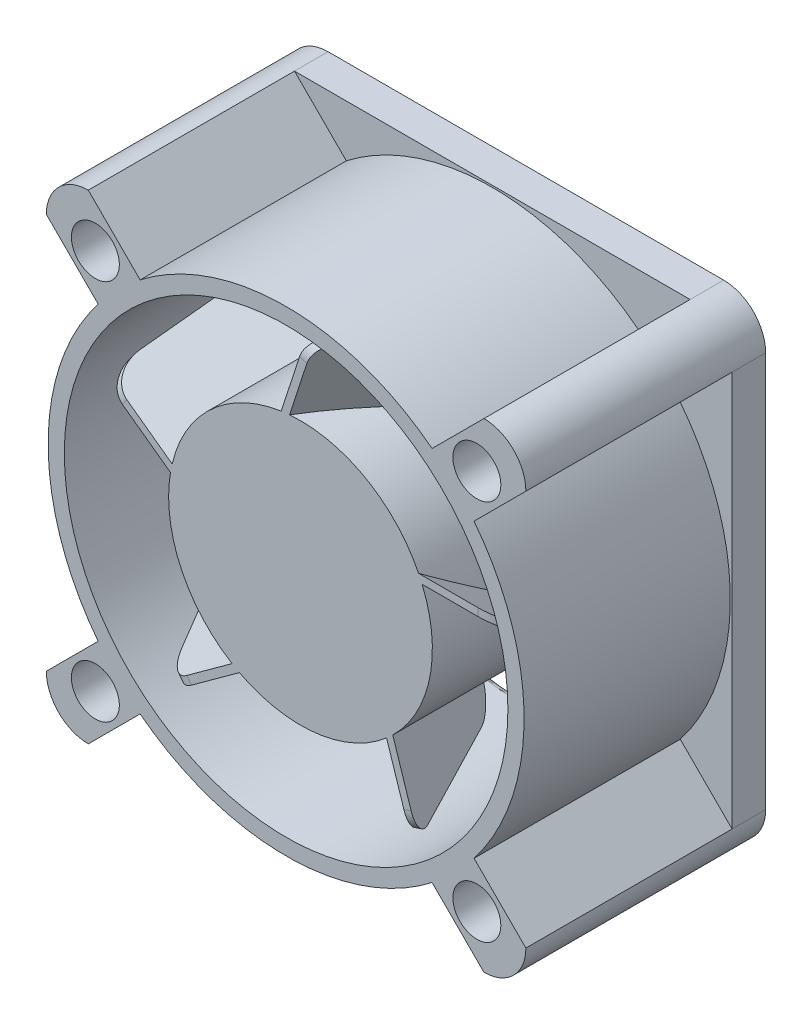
SolidWorks part; units mm, degrees
ref_plane "Face" through (0, 0, 0) normal (0, 0, 1) x (1, 0, 0)
ref_plane "Dessus" through (0, 0, 0) normal (0, 1, 0) x (1, 0, 0)
ref_plane "Droite" through (0, 0, 0) normal (1, 0, 0) x (0, 0, -1)
sketch "Esquisse1" plane through (0, 0, 0) normal (0, 0, 1) x (1, 0, 0)
  line L1 (-20.8134, 14.3716) -> (19.1866, 14.3716)
  line L2 (-20.8134, 14.3716) -> (-20.8134, -25.6284)
  line L3 (-20.8134, -25.6284) -> (19.1866, -25.6284)
  line L4 (19.1866, 14.3716) -> (19.1866, -25.6284)
  dimension "D1" = 40
  dimension "D2" = 40
extrude "Extrusion1" add sketch "Esquisse1" along normal blind 2.8
fillet "Congé1" radius 3.5 4 edges at (-20.8134, -25.6284, 1.4) (19.1866, -25.6284, 1.4) (19.1866, 14.3716, 1.4) (-20.8134, 14.3716, 1.4)
sketch "Esquisse2" plane through (0, 0, 2.8) normal (0, 0, 1) x (1, 0, 0)
  line L0 (-0.8134, 14.3716) -> (-0.8134, -24.6532) construction
  line L1 (15.6866, 14.3716) -> (-17.3134, 14.3716) construction
  line L2 (-20.8134, -5.6284) -> (15.6866, -5.6284) construction
  line L3 (-20.8134, 10.8716) -> (-20.8134, -22.1284) construction
  line L4 (-0.8134, -5.6284) -> (-21.1971, 14.7553) construction
  line L5 (-0.8134, -5.6284) -> (20.0819, 15.2669) construction
  line L6 (-0.8134, -5.6284) -> (20.0819, -26.5237) construction
  line L7 (-0.8134, -5.6284) -> (-20.8134, -25.6284) construction
  line L8 (-20.8134, 10.8716) -> (-16.4899, 6.5481)
  line L9 (-17.3134, 14.3716) -> (-12.9899, 10.0481)
  line L10 (15.6866, 14.3716) -> (11.3632, 10.0481)
  line L11 (19.1866, 10.8716) -> (14.8632, 6.5481)
  line L12 (19.1866, -22.1284) -> (14.8632, -17.805)
  line L13 (15.6866, -25.6284) -> (11.3632, -21.305)
  line L14 (-17.3134, -25.6284) -> (-12.9899, -21.305)
  line L15 (-20.8134, -22.1284) -> (-16.4899, -17.805)
  arc A0 (-17.3134, 14.3716) -> (-20.8134, 10.8716) centre (-17.3134, 10.8716) ccw construction
  arc A1 (-17.3134, 14.3716) -> (-20.8134, 10.8716) centre (-17.3134, 10.8716) ccw
  arc A2 (19.1866, 10.8716) -> (15.6866, 14.3716) centre (15.6866, 10.8716) ccw construction
  arc A3 (19.1866, 10.8716) -> (15.6866, 14.3716) centre (15.6866, 10.8716) ccw
  arc A4 (15.6866, -25.6284) -> (19.1866, -22.1284) centre (15.6866, -22.1284) ccw construction
  arc A5 (15.6866, -25.6284) -> (19.1866, -22.1284) centre (15.6866, -22.1284) ccw
  arc A6 (-20.8134, -22.1284) -> (-17.3134, -25.6284) centre (-17.3134, -22.1284) ccw construction
  arc A7 (-20.8134, -22.1284) -> (-17.3134, -25.6284) centre (-17.3134, -22.1284) ccw
  arc A8 (-16.4899, 6.5481) -> (-16.4899, -17.805) centre (-0.8134, -5.6284) ccw
  arc A9 (11.3632, 10.0481) -> (-12.9899, 10.0481) centre (-0.8134, -5.6284) ccw
  arc A10 (14.8632, -17.805) -> (14.8632, 6.5481) centre (-0.8134, -5.6284) ccw
  arc A11 (-12.9899, -21.305) -> (11.3632, -21.305) centre (-0.8134, -5.6284) ccw
extrude "Extrusion2" add sketch "Esquisse2" along normal blind 17.2
sketch "Esquisse3" plane through (0, 0, 20) normal (0, 0, 1) x (1, 0, 0)
  line L0 (-0.8134, 14.3716) -> (-0.8134, -27.2112) construction
  line L1 (15.6866, 14.3716) -> (-17.3134, 14.3716) construction
  line L2 (-20.8134, -5.6284) -> (22.4, -5.6284) construction
  line L3 (-20.8134, 10.8716) -> (-20.8134, -22.1284) construction
  line L4 (-0.8134, -5.6284) -> (19.6343, 14.8192) construction
  line L5 (-0.8134, -5.6284) -> (-21.6767, 15.2349) construction
  line L6 (-0.8134, -5.6284) -> (-22.9237, -27.7387) construction
  line L7 (-0.8134, -5.6284) -> (20.4336, -26.8754) construction
  circle A0 centre (-0.8134, -5.6284) radius 18.5
  circle A2 centre (-16.7233, 10.2815) radius 2
  circle A3 centre (15.0965, 10.2815) radius 2.001
  circle A4 centre (15.0965, -21.5383) radius 2
  circle A5 centre (-16.7233, -21.5383) radius 2
extrude "Enlèv. mat.-Extru.1" cut sketch "Esquisse3" against normal blind 22
sketch "Esquisse4" plane through (0, 0, 0) normal (0, 0, -1) x (-1, 0, 0)
  line L0 (0.8134, 14.3716) -> (0.8134, -27.339) construction
  line L1 (-15.6866, 14.3716) -> (17.3134, 14.3716) construction
  line L2 (-19.1866, -5.6284) -> (23.771, -5.6284) construction
  line L3 (-19.1866, -22.1284) -> (-19.1866, 10.8716) construction
  line L4 (7.9732, -13.9793) -> (12.0684, -20.9361)
  line L5 (6.1553, -15.2442) -> (10.0404, -22.2375)
  line L6 (-10.1851, -5.4468) -> (-18.184, -5.3147)
  line L7 (-9.9986, -7.6535) -> (-18.071, -7.7217)
  line L8 (6.4699, 3.8057) -> (10.5838, 10.667)
  line L9 (4.4656, 4.7476) -> (8.4427, 11.7725)
  arc A0 (4.4656, 4.7476) -> (-10.1851, -5.4468) centre (0.8134, -5.6284) ccw
  arc A2 (10.0404, -22.2375) -> (12.0684, -20.9361) centre (0.8134, -5.6284) ccw
  arc A4 (10.5838, 10.667) -> (8.4427, 11.7725) centre (0.8134, -5.6284) ccw
  arc A5 (-9.9986, -7.6535) -> (6.1553, -15.2442) centre (0.8134, -5.6284) ccw
  arc A6 (7.9732, -13.9793) -> (6.4699, 3.8057) centre (0.8134, -5.6284) ccw
  arc A7 (-18.184, -5.3147) -> (-18.071, -7.7217) centre (0.8134, -5.6284) ccw
extrude "Extrusion3" add sketch "Esquisse4" against normal blind 2.8
fillet "Congé2" radius 0.5 12 edges at (3.8647, -15.5841, 0) (13.7834, -7.6855, 0) (7.6519, -22.078, 0) (-7.9765, -18.5223, 0) (-8.3983, 7.0219, 0) (-11.7743, -4.702, 0) (-9.8933, -17.2411, 0) (-19.2918, -4.7348, 0) (5.4694, 3.4008, 0) (-6.3303, 8.0413, 0) (9.1998, 9.9275, 0) (13.9346, -5.3849, 0)
fillet "Congé3" radius 1 24 edges at (17.6353, -7.658, 0.2625) (-11.7954, -20.5907, 0.2625) (9.9388, -7.5811, 0.2417) (-6.1802, -15.1568, 0.2549) (-8.2801, 11.3634, 0.2625) (-10.3044, 10.3266, 0.2543) (-7.8806, -13.9638, 0.2417) (-6.3818, 3.7836, 0.2549) (-9.8853, -21.8254, 0.2543) (10.1218, -5.512, 0.2549) (-4.4984, 4.6596, 0.2417) (17.7496, -5.3864, 0.2543) (17.5683, -7.7175, 1.65) (-11.8134, -20.5029, 1.65) (9.9986, -7.6535, 1.65) (-6.1553, -15.2442, 1.65) (-8.1951, 11.3351, 1.65) (-10.3267, 10.2381, 1.65) (-7.9732, -13.9793, 1.65) (-6.4699, 3.8057, 1.65) (-9.7976, -21.8004, 1.65) (10.1851, -5.4468, 1.65) (-4.4656, 4.7476, 1.65) (17.6841, -5.3229, 1.65)
sketch "Esquisse5" plane through (0, 0, 2.8) normal (0, 0, 1) x (1, 0, 0)
  circle A0 centre (-0.8134, -5.6284) radius 11
extrude "Extrusion4" add sketch "Esquisse5" along normal blind 16
sketch "Esquisse6" plane through (0, 0, 0) normal (1, 0, 0) x (0, 0, -1)
  line L0 (-18.8, -1.3758) -> (-3.2466, -11.4158)
  line L1 (-18.8, 5.3716) -> (-18.8, -16.6284) construction
  line L2 (-18.8, -1.3758) -> (-18.8, -0.7363)
  line L3 (-18.8, -0.7363) -> (-3.2466, -10.7763)
  line L4 (-3.2466, -10.7763) -> (-3.2466, -11.4158)
extrude "Extrusion5" add sketch "Esquisse6" along normal blind 16
pattern_circular "Répétition circulaire2" count 5 over 360 about axis through (-0.8134, -5.6284, 0) along (0, 0, 1) of "Extrusion5"
fillet "Congé4" radius 2 10 edges at (16, -11.096, 3.2466) (16, -1.0561, 18.8) (-0.8178, -23.3085, 3.2466) (-17.6295, -11.0877, 3.2466) (9.5823, 8.6725, 3.2466) (-11.2019, 8.6776, 3.2466) (-17.1032, 0.5551, 18.8) (-11.7281, -19.2102, 18.8) (8.7308, -20.206, 18.8) (0.0337, 11.775, 18.8)
